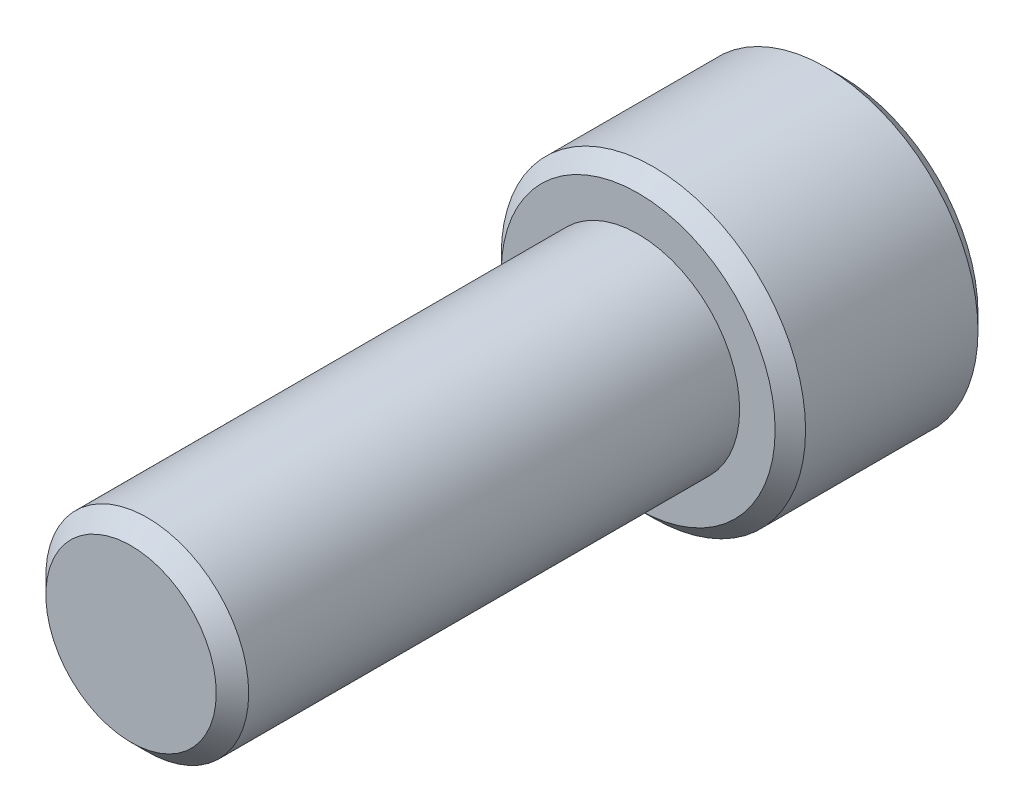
SolidWorks part; units mm, degrees
ref_plane "Front Plane" through (0, 0, 0) normal (0, 0, 1) x (1, 0, 0)
ref_plane "Top Plane" through (0, 0, 0) normal (0, 1, 0) x (1, 0, 0)
ref_plane "Right Plane" through (0, 0, 0) normal (1, 0, 0) x (0, 0, -1)
sketch "Sketch1" plane through (0, 0, 0) normal (0, 0, 1) x (1, 0, 0)
  circle A0 centre (0, 0) radius 3.175
  dimension "OD" = 6.35
extrude "Extrude1" add sketch "Sketch1" against normal blind 15.875
sketch "Sketch6" plane through (0, 0, -15.875) normal (0, 0, -1) x (-1, 0, 0)
  circle A0 centre (0, 0) radius 4.7625
  dimension "head dia" = 9.525
extrude "Extrude2" add sketch "Sketch6" along normal blind 6.35
sketch "Sketch7" plane through (0, 0, -22.225) normal (0, 0, -1) x (-1, 0, 0)
  line L1 (0, 2.7496) -> (-2.3812, 1.3748)
  line L2 (-2.3812, 1.3748) -> (-2.3812, -1.3748)
  line L3 (-2.3812, -1.3748) -> (0, -2.7496)
  line L4 (0, -2.7496) -> (2.3813, -1.3748)
  line L5 (2.3813, -1.3748) -> (2.3813, 1.3748)
  line L6 (2.3813, 1.3748) -> (0, 2.7496)
  circle A0 centre (0, 0) radius 2.3813 construction
  dimension "hex dia" = 4.7625
extrude "Cut-Extrude1" cut sketch "Sketch7" against normal blind 3.5719
sketch "Sketch8" plane through (0, 0, -22.225) normal (0, 0, -1) x (-1, 0, 0)
  circle A0 centre (0, 0) radius 2.7496
extrude "Cut-Extrude2" cut sketch "Sketch8" against normal through all draft 45
chamfer "Chamfer1" distance 0.4763 angle 45 2 edges at (-4.7625, 0, -22.225) (-4.7625, 0, -15.875)
chamfer "Chamfer2" distance 0.508 angle 45 1 edges at (3.175, 0, 0)
